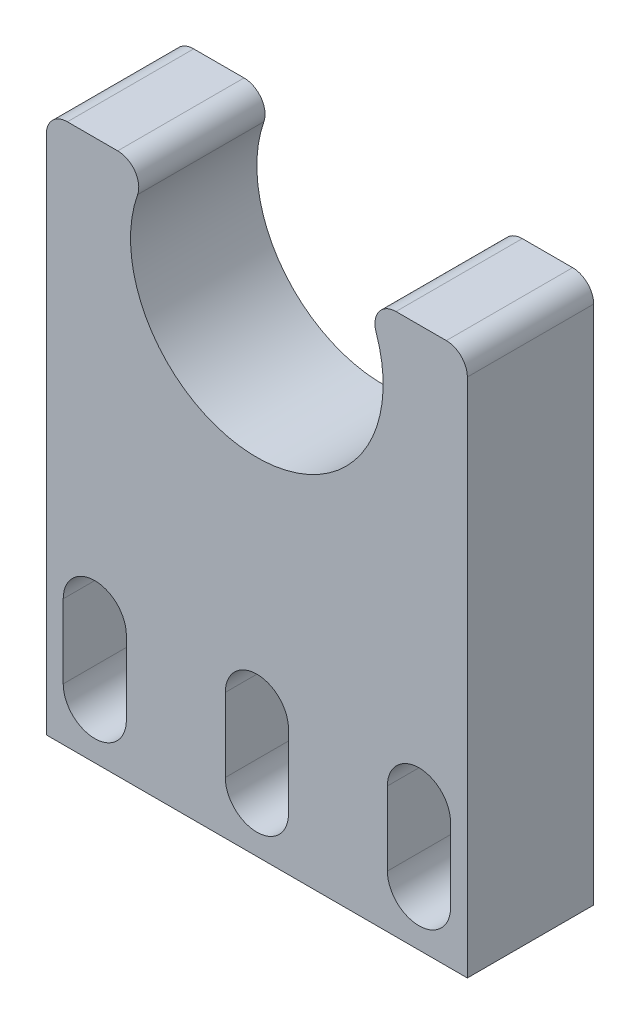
SolidWorks part; units mm, degrees
ref_plane "Front Plane" through (0, 0, 0) normal (0, 0, 1) x (1, 0, 0)
ref_plane "Top Plane" through (0, 0, 0) normal (0, 1, 0) x (1, 0, 0)
ref_plane "Right Plane" through (0, 0, 0) normal (1, 0, 0) x (0, 0, -1)
sketch "Sketch1" plane through (0, 0, 0) normal (0, 0, 1) x (1, 0, 0)
  line L0 (-235.0401, 18.6986) -> (-235.0401, 15.1986) construction
  line L1 (-233.5401, 18.6986) -> (-233.5401, 15.1986)
  line L2 (-236.5401, 18.6986) -> (-236.5401, 15.1986)
  line L3 (-227.3401, 18.6986) -> (-227.3401, 15.1986) construction
  line L4 (-225.8401, 18.6986) -> (-225.8401, 15.1986)
  line L5 (-228.8401, 18.6986) -> (-228.8401, 15.1986)
  line L6 (-219.6401, 18.6986) -> (-219.6401, 15.1986) construction
  line L7 (-218.1401, 18.6986) -> (-218.1401, 15.1986)
  line L8 (-221.1401, 18.6986) -> (-221.1401, 15.1986)
  line L9 (-227.3422, 12.6986) -> (-217.3422, 12.6986)
  line L10 (-217.3422, 12.6986) -> (-217.3422, 33.5025)
  line L12 (-227.3422, 41.114) -> (-227.3422, 29.114) construction
  line L13 (-220.7331, 38.4206) -> (-218.3422, 38.4206)
  line L14 (-237.3422, 12.6986) -> (-237.3422, 33.5025)
  line L15 (-237.3422, 12.6986) -> (-227.3422, 12.6986)
  line L16 (-233.9512, 38.4206) -> (-236.3422, 38.4206)
  line L17 (-237.3422, 37.4206) -> (-237.3422, 33.5025)
  line L18 (-217.3422, 37.4206) -> (-217.3422, 33.5025)
  arc A0 (-233.5401, 18.6986) -> (-236.5401, 18.6986) centre (-235.0401, 18.6986) ccw
  arc A1 (-236.5401, 15.1986) -> (-233.5401, 15.1986) centre (-235.0401, 15.1986) ccw
  arc A2 (-225.8401, 18.6986) -> (-228.8401, 18.6986) centre (-227.3401, 18.6986) ccw
  arc A3 (-228.8401, 15.1986) -> (-225.8401, 15.1986) centre (-227.3401, 15.1986) ccw
  arc A4 (-218.1401, 18.6986) -> (-221.1401, 18.6986) centre (-219.6401, 18.6986) ccw
  arc A5 (-221.1401, 15.1986) -> (-218.1401, 15.1986) centre (-219.6401, 15.1986) ccw
  arc A6 (-233.0071, 37.0911) -> (-221.6773, 37.0911) centre (-227.3422, 35.114) ccw
  arc A7 (-217.3422, 37.4206) -> (-218.3422, 38.4206) centre (-218.3422, 37.4206) ccw
  arc A8 (-237.3422, 37.4206) -> (-236.3422, 38.4206) centre (-236.3422, 37.4206) cw
  arc A9 (-220.7331, 38.4206) -> (-221.6773, 37.0911) centre (-220.7331, 37.4206) ccw
  arc A10 (-233.0071, 37.0911) -> (-233.9512, 38.4206) centre (-233.9512, 37.4206) ccw
  point P2 (-235.0401, 16.9486)
  point P11 (-227.3401, 16.9486)
  point P18 (-219.6401, 16.9486)
  point P33 (-217.3422, 35.114)
  point P36 (-237.3422, 35.114)
  point P41 (-222.3355, 38.4206)
  point P44 (-232.3488, 38.4206)
  dimension "D4" = 1
  dimension "D5" = 1
  dimension "D1" = 3
  dimension "D2" = 3.5
  dimension "D3" = 3
extrude "Boss-Extrude2" add sketch "Sketch1" along normal blind 6
